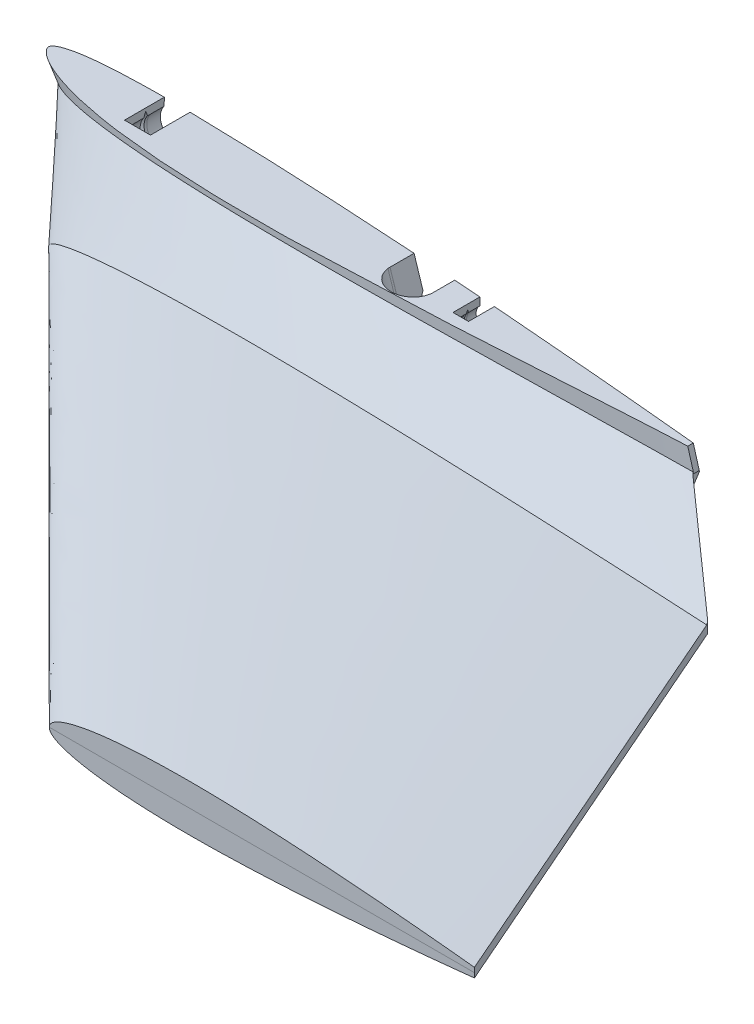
SolidWorks part; units mm, degrees
other "<winglet-wyciety>-<Cut-Extrude3>"
ref_plane "Front Plane" through (0, 0, 0) normal (0, 0, 1) x (1, 0, 0)
ref_plane "Top Plane" through (0, 0, 0) normal (0, 1, 0) x (1, 0, 0)
ref_plane "Right Plane" through (0, 0, 0) normal (1, 0, 0) x (0, 0, -1)
ref_plane "Front Plane-winglet-wyciety_Mirrored" through (0, 0, 0) normal (0, 0, 1) x (1, 0, 0)
ref_plane "Top Plane-winglet-wyciety_Mirrored" through (0, 0, 0) normal (0, -1, 0) x (1, 0, 0)
ref_plane "Right Plane-winglet-wyciety_Mirrored" through (0, 0, 0) normal (1, 0, 0) x (0, 0, -1)
ref_plane "Plane2-winglet-wyciety_Mirrored" through (0, -850, 0) normal (0, -1, 0) x (1, 0, 0)
sketch "Sketch2-winglet-wyciety_Mirrored" plane through (0, -850, 0) normal (0, 1, 0) x (1, 0, 0)
  line L1 (699.9846, -14.1421) -> (734.9846, -94.1421)
  line L2 (734.9846, -94.1421) -> (726.9846, -94.1421)
  line L4 (699.9846, -14.1421) -> (691.9846, -14.1421)
  line L5 (691.9846, -14.1421) -> (726.9846, -94.1421)
  dimension "D1" = 8
  dimension "D2" = 8
sketch "Sketch4-winglet-wyciety_Mirrored" plane through (0, 0, 0) normal (0, 0, -1) x (1, 0, 0)
  line L1 (686.9348, 850) -> (685.759, 846)
  line L2 (685.759, 846) -> (677.759, 845.9995)
  line L4 (686.9348, 850) -> (678.9348, 850)
  line L5 (678.9348, 850) -> (677.759, 845.9995)
  dimension "D1" = 8
  dimension "D2" = 8
sketch "Sketch6-winglet-wyciety_Mirrored" plane through (0, -850, 0) normal (0, -1, 0) x (1, 0, 0)
  line L0 (678.9348, 3.9753) -> (691.9846, 14.1421)
  line L1 (691.9846, 14.1421) -> (706.0014, 16.2961)
  line L2 (706.0014, 16.2961) -> (707.6728, -5.9947)
  line L3 (707.6728, -5.9947) -> (679.9939, -5.3964)
  line L4 (679.9939, -5.3964) -> (678.9348, 2.7264)
  line L5 (678.9348, 2.7264) -> (678.9348, 3.9753)
sketch "Sketch7-winglet-wyciety_Mirrored" plane through (0, -850, 0) normal (0, 1, 0) x (1, 0, 0)
  line L0 (682.8476, 0) -> (684.553, -5.4986)
  line L1 (684.553, -5.4986) -> (696.4669, -7.1067)
  line L2 (696.4669, -7.1067) -> (696.7349, -1.3325)
  line L3 (696.7349, -1.3325) -> (682.8476, 0)
mirrored part "winglet-wyciety_Mirrored" parameters "D1.Plane2"=850, "D1.Sketch2"=8, "D2.Sketch2"=8, "D1.Sketch4"=8, "D2.Sketch4"=8
other "Cavity1"
other "os<1>@skrzydlo1"
other "Cavity6"
other "zebro-zamykajace<1>@skrzydlo5"
sketch "Sketch2" plane through (0, 0, 0) normal (0, 0, 1) x (1, 0, 0)
  line L0 (573.9852, -846) -> (573.9852, -847.4997)
  line L1 (632.7843, -846) -> (632.7843, -847.4997) construction
  line L3 (635.7843, -846) -> (635.7843, -847.4997)
  line L4 (568.9852, -846) -> (568.9852, -847.4997) construction
  line L7 (632.7843, -846) -> (632.7843, -847.4997)
  line L10 (568.9852, -846) -> (568.9852, -847.4997)
  line L12 (627.553, -846) -> (619.1443, -846) construction
  line L13 (621.3018, -852.665) -> (628.3662, -850.3845)
  line L14 (628.3662, -850.3845) -> (626.2159, -838.7914)
  line L15 (621.3018, -852.665) -> (617.7102, -841.5697)
  line L16 (626.2159, -838.7914) -> (617.7102, -841.5697)
  line L17 (635.7843, -846) -> (635.7843, -836.0553)
  line L18 (635.7843, -836.0553) -> (632.7843, -836.0553)
  line L19 (632.7843, -836.0553) -> (632.7843, -846)
  line L20 (573.9852, -846) -> (573.9852, -835.5415)
  line L21 (573.9852, -835.5415) -> (568.9852, -835.5415)
  line L22 (568.9852, -835.5415) -> (568.9852, -846)
  arc A0 (632.7843, -847.4997) -> (633.5843, -851.5868) centre (634.2843, -849.328) ccw construction
  arc A1 (568.9852, -847.4997) -> (570.4852, -852.5369) centre (571.4852, -849.4972) ccw construction
  arc A5 (568.9852, -847.4997) -> (573.9852, -847.4997) centre (571.4852, -849.4972) ccw
  arc A6 (632.7843, -847.4997) -> (635.7843, -847.4997) centre (634.2843, -849.328) ccw
  point P21 (571.4852, -849.4972)
  point P23 (634.2843, -849.328)
extrude "Cut-Extrude1" cut sketch "Sketch2" along normal blind 3 and the other way through all
sketch "Sketch3" plane through (0, 0, 4.0833) normal (0, 0, -1) x (-1, 0, 0)
  line L0 (-634.9843, -846) -> (-633.5843, -846) construction
  line L1 (-635.7843, -846) -> (-634.9843, -846) construction
  line L2 (-633.5843, -846) -> (-632.7843, -846) construction
  line L3 (-632.7843, -847.4997) -> (-632.7843, -846) construction
  line L4 (-635.7843, -847.4997) -> (-635.7843, -846) construction
  line L5 (-634.9843, -846) -> (-633.5843, -846)
  line L6 (-635.7843, -846) -> (-634.9843, -846)
  line L7 (-633.5843, -846) -> (-632.7843, -846)
  line L8 (-632.7843, -847.4997) -> (-632.7843, -846)
  line L9 (-635.7843, -847.4997) -> (-635.7843, -846)
  arc A0 (-633.5843, -851.5868) -> (-632.7843, -847.4997) centre (-634.2843, -849.328) ccw construction
  arc A1 (-634.9843, -851.5868) -> (-633.5843, -851.5868) centre (-634.2843, -849.328) ccw construction
  arc A2 (-632.8231, -851.1874) -> (-632.7843, -847.4997) centre (-634.2843, -849.328) ccw construction
  arc A3 (-635.7843, -847.4997) -> (-634.9843, -851.5868) centre (-634.2843, -849.328) ccw construction
  arc A4 (-633.5843, -851.5868) -> (-632.7843, -847.4997) centre (-634.2843, -849.328) ccw
  arc A5 (-634.9843, -851.5868) -> (-633.5843, -851.5868) centre (-634.2843, -849.328) ccw
  arc A6 (-632.8231, -851.1874) -> (-632.7843, -847.4997) centre (-634.2843, -849.328) ccw
  arc A7 (-635.7843, -847.4997) -> (-634.9843, -851.5868) centre (-634.2843, -849.328) ccw
extrude "Cut-Extrude2" cut sketch "Sketch3" along normal blind 10 contours A5 A4 L8 L7 L5 M4 | M4 M1 M2 M3
sketch "Sketch4" plane through (0, 0, 3.6309) normal (0, 0, -1) x (-1, 0, 0)
  line L0 (-568.9852, -846) -> (-568.9852, -847.4997) construction
  line L4 (-573.9852, -847.4997) -> (-573.9852, -845.9999) construction
  line L5 (-568.9852, -846) -> (-568.9852, -847.4997)
  line L6 (-573.9852, -845.9999) -> (-568.9852, -846)
  line L9 (-573.9852, -847.4997) -> (-573.9852, -845.9999)
  arc A0 (-573.9852, -847.4997) -> (-572.4852, -852.5369) centre (-571.4852, -849.4972) ccw construction
  arc A1 (-572.4852, -852.5369) -> (-570.4852, -852.5369) centre (-571.4852, -849.4972) ccw construction
  arc A2 (-570.4852, -852.5369) -> (-568.9852, -847.4997) centre (-571.4852, -849.4972) ccw construction
  arc A3 (-573.9852, -847.4997) -> (-572.4852, -852.5369) centre (-571.4852, -849.4972) ccw
  arc A4 (-572.4852, -852.5369) -> (-570.4852, -852.5369) centre (-571.4852, -849.4972) ccw
  arc A5 (-570.4852, -852.5369) -> (-568.9852, -847.4997) centre (-571.4852, -849.4972) ccw
extrude "Cut-Extrude3" cut sketch "Sketch4" along normal blind 10
